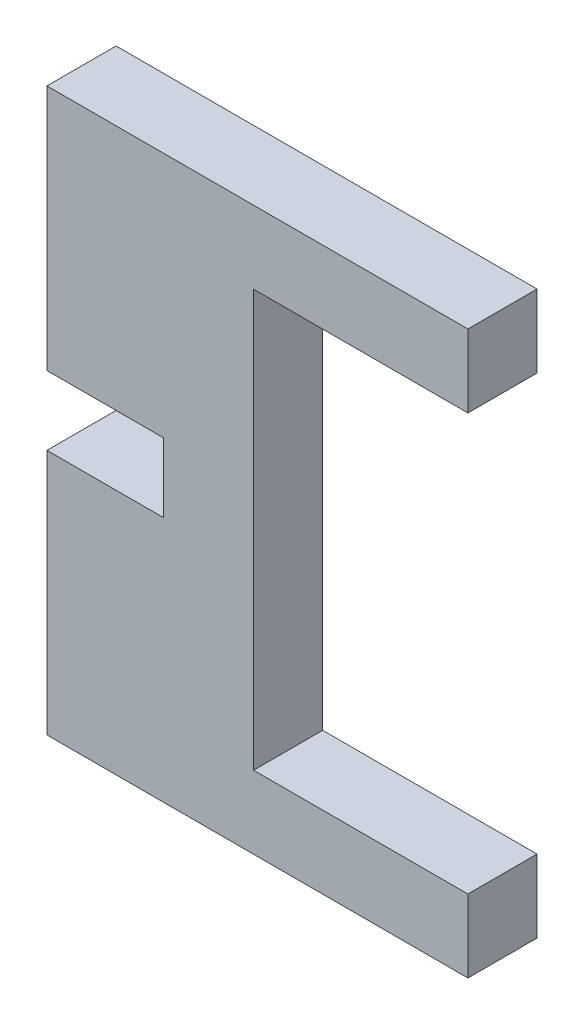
SolidWorks part; units mm, degrees
ref_plane "Front" through (0, 0, 0) normal (0, 0, 1) x (1, 0, 0)
ref_plane "Top" through (0, 0, 0) normal (0, 1, 0) x (1, 0, 0)
ref_plane "Right" through (0, 0, 0) normal (1, 0, 0) x (0, 0, -1)
sketch "Sketch1" plane through (0, 0, 0) normal (0, 0, 1) x (1, 0, 0)
  line L0 (0, 2.921) -> (0, -2.921)
  line L1 (0, -2.921) -> (-9.8376, -2.921)
  line L2 (-9.8376, -2.921) -> (-9.8376, -23.7494)
  line L3 (-9.8376, -23.7494) -> (25.7368, -23.7494)
  line L4 (25.7368, -23.7494) -> (25.7368, -17.6022)
  line L5 (25.7368, -17.6022) -> (7.62, -17.6022)
  line L6 (7.62, -17.6022) -> (7.62, 17.6022)
  line L7 (0, 0) -> (7.62, 0) construction
  line L8 (25.7368, 17.6022) -> (7.62, 17.6022)
  line L9 (25.7368, 23.7494) -> (25.7368, 17.6022)
  line L10 (-9.8376, 23.7494) -> (25.7368, 23.7494)
  line L11 (-9.8376, 2.921) -> (-9.8376, 23.7494)
  line L12 (0, 2.921) -> (-9.8376, 2.921)
  dimension "D1" = 2.921
  dimension "D2" = 7.62
  dimension "D3" = 35.2044
  dimension "D4" = 47.4988
extrude "Extrude1" add sketch "Sketch1" along normal blind 5.842
